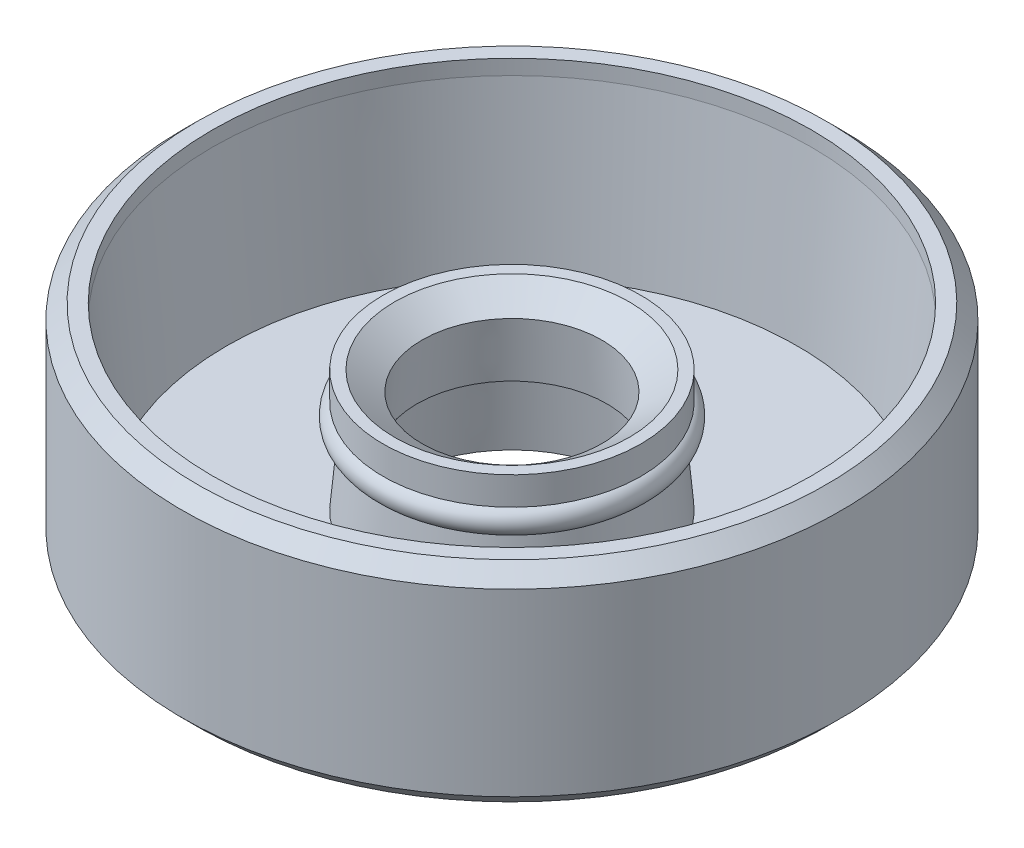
SolidWorks part; units mm, degrees
ref_plane "前视基准面" through (0, 0, 0) normal (0, 0, 1) x (1, 0, 0)
ref_plane "上视基准面" through (0, 0, 0) normal (0, 1, 0) x (1, 0, 0)
ref_plane "右视基准面" through (0, 0, 0) normal (1, 0, 0) x (0, 0, -1)
sketch "草图1" plane through (0, 0, 0) normal (0, 0, 1) x (1, 0, 0)
  line L0 (0, 5.8362) -> (0, -13.0481) construction
  line L1 (-9.5188, 1) -> (-4.3019, 1)
  line L2 (-10.5, 0) -> (-3.8874, 0)
  line L3 (-10, 6.5) -> (-9.5188, 1)
  line L4 (-11, 6.5) -> (-11, 0.5)
  line L5 (-10, 6.5) -> (-10, 7)
  line L6 (-11, 0.5) -> (-10.5, 0)
  line L7 (-10, 7) -> (-10.5, 7)
  line L8 (-10.5, 7) -> (-11, 6.5)
  line L9 (-3.1687, 2.5) -> (-3, 4.4286)
  line L10 (-3.1687, 2.5) -> (-3.6687, 2.5)
  line L11 (-3.8874, 0) -> (-3.6687, 2.5)
  line L12 (-4.1019, 3.286) -> (-4.3019, 1)
  line L13 (-3.9181, 5.0714) -> (-4.3019, 5.0714)
  line L14 (-4.3019, 5.0714) -> (-4.3019, 4.1332)
  line L15 (-3, 4.4286) -> (-3.9181, 5.0714)
  line L16 (-10.5, 0) -> (-10.5, 0.5) construction
  line L17 (-4.2265, 1.8612) -> (-3.7284, 1.8176) construction
  line L18 (-9.5188, 1) -> (-9.5188, 0.5) construction
  arc A0 (-4.3019, 4.1332) -> (-4.1019, 3.286) centre (-4.1019, 3.7332) ccw
  dimension "D10" = 1.9286
  dimension "D6" = 95
  dimension "b" = 7
  dimension "D2" = 135
  dimension "D3" = 45
  dimension "D4" = 145
  dimension "D5" = 85
  dimension "D7" = 0.2
  dimension "D8" = 0.4
  dimension "D9" = 2.5
  dimension "D11" = 0.6429
  dimension "dm" = 22
  dimension "d1" = 6
  dimension "r" = 0.5
revolve "旋转1" add sketch "草图1" angle 360 about L0
equation "\"D9@草图1\" = \"b@草图1\" / 2 - 1"
equation "\"D10@草图1\" =  ( \"b@草图1\" - \"D9@草图1\" )  / 7 * 3"
equation "\"D11@草图1\" = \"D10@草图1\" / 3"
equation "\"D8@草图1\" = \"r@草图1\" / 5 * 4"
equation "\"D7@草图1\" = \"D8@草图1\" / 2"
